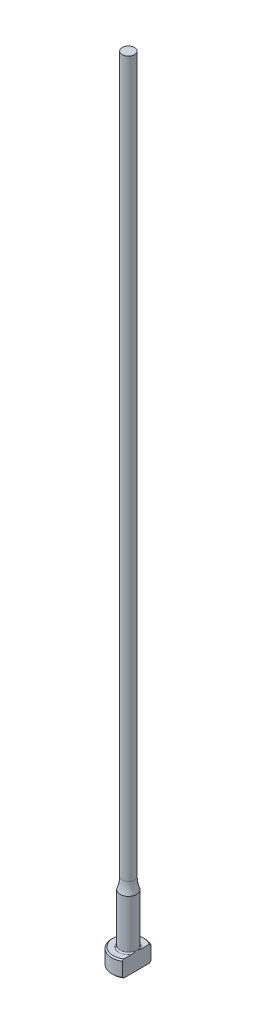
SolidWorks part; units mm, degrees
ref_plane "Front Plane" through (0, 0, 0) normal (0, 0, 1) x (1, 0, 0)
ref_plane "Top Plane" through (0, 0, 0) normal (0, 1, 0) x (1, 0, 0)
ref_plane "Right Plane" through (0, 0, 0) normal (1, 0, 0) x (0, 0, -1)
sketch "Sketch1" plane through (0, 0, 0) normal (0, 0, 1) x (1, 0, 0)
  line L0 (0, 259.9588) -> (0, -15.1925) construction
  line L1 (0, 0) -> (-3.175, 0)
  line L2 (-3.175, 0) -> (-3.175, 3.175)
  line L3 (-3.175, 3.175) -> (-1.5875, 3.175)
  line L4 (-1.19, 14.9114) -> (-1.19, 152.4)
  line L5 (-1.19, 152.4) -> (0, 152.4)
  line L6 (0, 152.4) -> (0, 0)
  line L7 (-1.5875, 3.175) -> (-1.5875, 12.7)
  arc A0 (-1.5875, 12.7) -> (-1.19, 14.9114) centre (-7.54, 14.9114) ccw
  point P13 (-1.5875, 0)
  dimension "D1" = 6.35
  dimension "L" = 152.4
  dimension "D2" = 3.175
  dimension "H" = 6.35
  dimension "T" = 3.175
  dimension "D" = 2.38
  dimension "S" = 12.7
revolve "Revolve1" add sketch "Sketch1" angle 360 about L0
chamfer "Chamfer1" distance 0.254 angle 45 2 edges at (0, 3.175, 3.175) (0, 0, 3.175)
fillet "Fillet1" radius 0.254 1 edges at (0, 3.175, 1.5875)
sketch "Sketch2" plane through (0, 0, 0) normal (0, 1, 0) x (1, 0, 0)
  line L0 (1.5875, -2.7496) -> (1.5875, 2.7496)
  circle A0 centre (0, 0) radius 3.175 construction
  arc A2 (1.5875, -2.7496) -> (1.5875, 2.7496) centre (0, 0) ccw
  circle A3 centre (0, 0) radius 3.175 construction
  circle A4 centre (0, 0) radius 1.5875 construction
extrude "Key Head" cut sketch "Sketch2" along normal up to next
